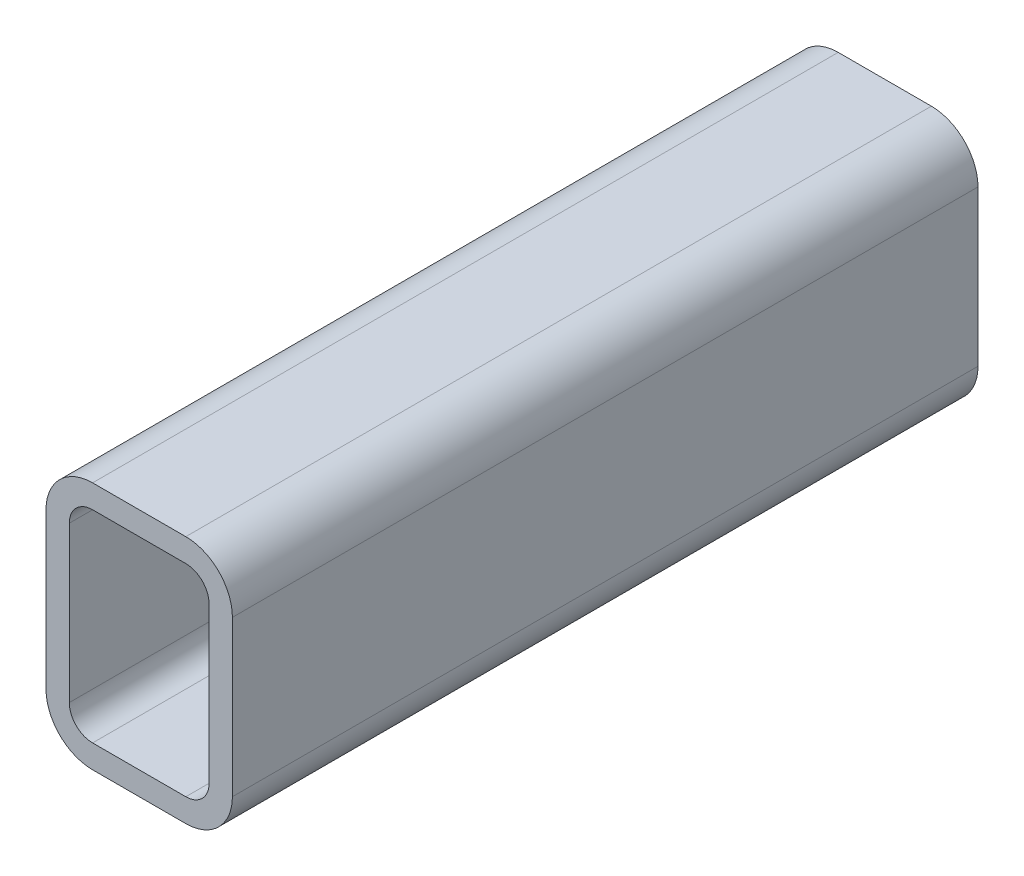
SolidWorks part; units mm, degrees
ref_plane "Front Plane" through (0, 0, 0) normal (0, 0, 1) x (1, 0, 0)
ref_plane "Top Plane" through (0, 0, 0) normal (0, 1, 0) x (1, 0, 0)
ref_plane "Right Plane" through (0, 0, 0) normal (1, 0, 0) x (0, 0, -1)
sketch "Sketch1" plane through (0, 0, 0) normal (0, 0, 1) x (1, 0, 0)
sketch_block_instance "HSS4x3x0.375-1"
sketch_block "HSS4x3x0.375"
extrude "Boss-Extrude1" add sketch "Sketch1" along normal blind 304.8
